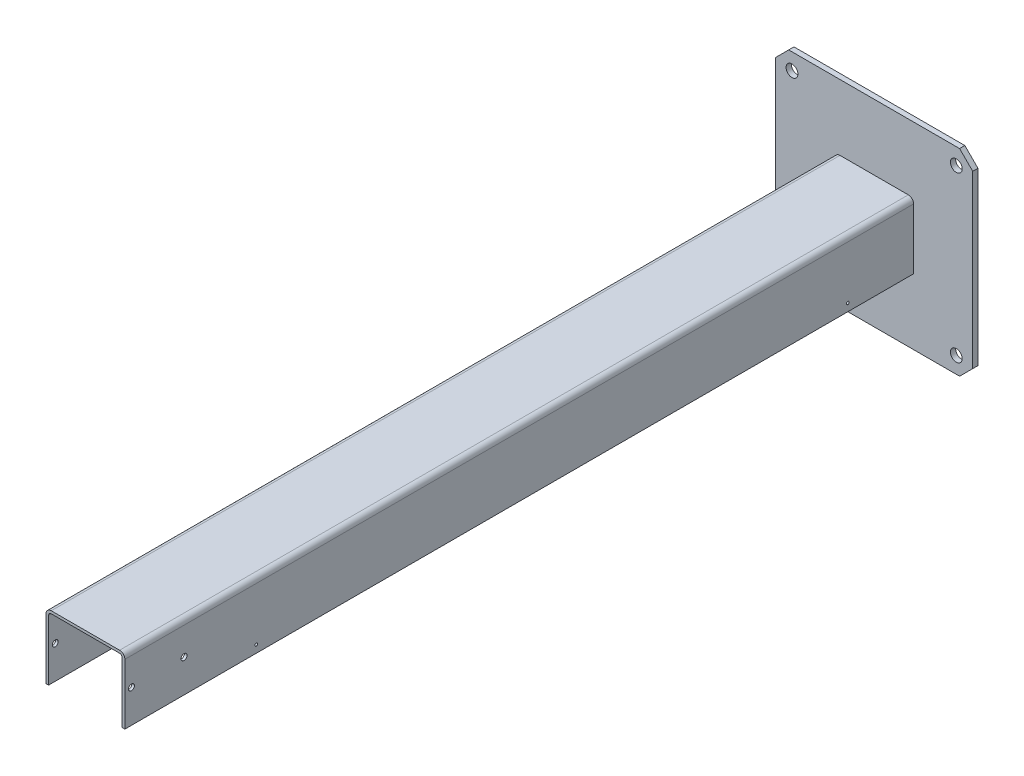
SolidWorks part; units mm, degrees
ref_plane "Plan1" through (0, 0, 0) normal (0, 0, 1) x (1, 0, 0)
ref_plane "Plan2" through (0, 0, 0) normal (0, 1, 0) x (1, 0, 0)
ref_plane "Plan3" through (0, 0, 0) normal (1, 0, 0) x (0, 0, -1)
sketch "Esquisse1" plane through (0, 0, 0) normal (0, 0, 1) x (1, 0, 0)
  line L0 (150, 150) -> (-150, -150) construction
  line L1 (-150, -150) -> (150, -150)
  line L2 (-150, -150) -> (-150, 150)
  line L3 (-150, 150) -> (150, 150)
  line L4 (150, -150) -> (150, 150)
  dimension "D1" = 300
extrude "Base-Extrusion" add sketch "Esquisse1" along normal blind 8
sketch "Esquisse2" plane through (0, 0, 8) normal (0, 0, 1) x (1, 0, 0)
  line L0 (-60, -50) -> (-60, 50)
  line L1 (-60, 50) -> (60, 50)
  line L2 (60, 50) -> (60, -50)
  dimension "D1" = 120
  dimension "D2" = 100
  dimension "D3" = 60
  dimension "D4" = 50
extrude "Boss.-Extru.-Mince1" add sketch "Esquisse2" along normal blind 1200 thin
sketch "Esquisse5" plane through (0, 0, 8) normal (0, 0, 1) x (1, 0, 0)
  line L0 (125, 125) -> (-125, -125) construction
  line L1 (-125, 125) -> (125, -125) construction
  circle A0 centre (125, 125) radius 9
  circle A1 centre (125, -125) radius 9
  circle A2 centre (-125, -125) radius 9
  circle A3 centre (-125, 125) radius 9
  dimension "D1" = 18
  dimension "D2" = 250
  dimension "D3" = 250
extrude "Enlèv. mat.-Extru.2" cut sketch "Esquisse5" against normal through all
chamfer "Chanfrein1" distance 20 angle 45 4 edges at (-150, 150, 4) (150, 150, 4) (150, -150, 4) (-150, -150, 4)
hole_wizard "Trou taraudé M5x0.81" positions "Esquisse7" profile "Esquisse6" tap size "M5x0.8" standard "Ansi Métrique"
sketch "Esquisse7" plane through (60, 0, 0) normal (1, 0, 0) x (0, 0, -1)
  line L0 (-8, -130) -> (-8, 130) construction
  line L1 (-1208, 50) -> (-8, 50) construction
  point P0 (-1008, -38.5)
  point P1 (-108, -38.5)
  dimension "D1" = 900
  dimension "D2" = 100
  dimension "D3" = 88.5
sketch "Esquisse6" plane through (60, -38.5, 1008) normal (0, 1, 0) x (0, 0, -1)
  line L0 (0, 0) -> (0, 210)
  line L1 (0, 210) -> (2.1, 210)
  line L2 (2.1, 210) -> (2.1, 0)
  line L5 (2.1, 0) -> (0, 0)
  line L11 (0, -6.35) -> (0, 107.95) construction
  dimension "Diamètre du perçage jusqu'au prochain" = 4.2
  dimension "Profondeur du perçage jusqu'au prochain" = 210
sketch "Esquisse8" plane through (-60, 0, 0) normal (-1, 0, 0) x (0, 0, 1)
  line L0 (1208, -50) -> (1208, 42) construction
  line L1 (1208, 50) -> (8, 50) construction
  circle A0 centre (1198, 0) radius 4.5
  circle A1 centre (1118, 0) radius 4.5
  dimension "D1" = 80
  dimension "D2" = 10
  dimension "D3" = 9
  dimension "D4" = 50
extrude "Enlèv. mat.-Extru.3" cut sketch "Esquisse8" against normal through all
